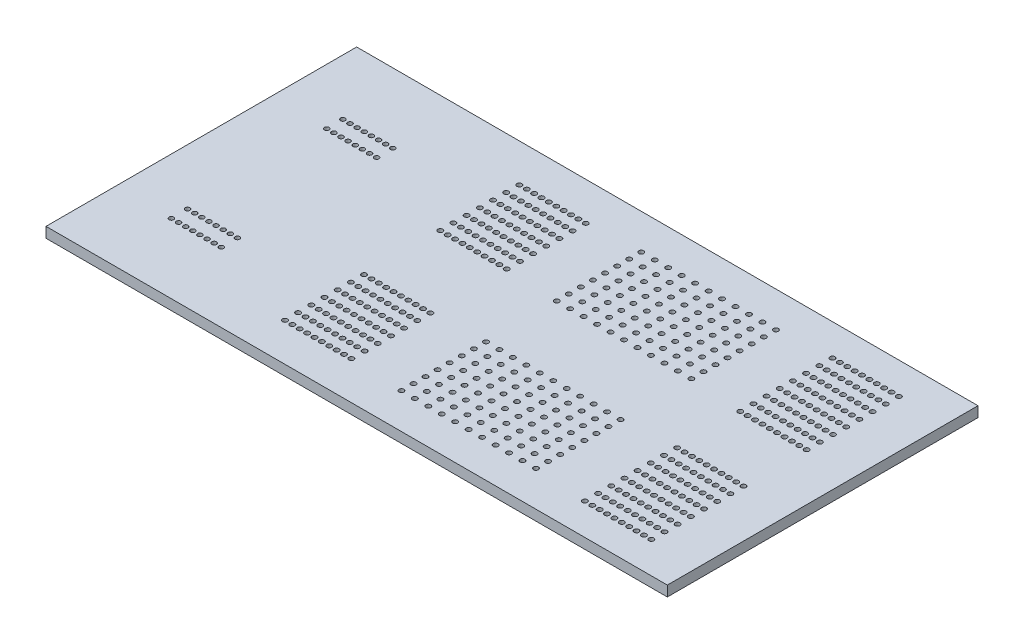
SolidWorks part; units mm, degrees
ref_plane "Plan de face" through (0, 0, 0) normal (0, 0, 1) x (1, 0, 0)
ref_plane "Plan de dessus" through (0, 0, 0) normal (0, 1, 0) x (1, 0, 0)
ref_plane "Plan de droite" through (0, 0, 0) normal (1, 0, 0) x (0, 0, -1)
sketch "Esquisse2" plane through (0, 0, 0) normal (0, 1, 0) x (1, 0, 0)
  line L1 (-60, -15) -> (60, -15)
  line L2 (-60, -15) -> (-60, 15)
  line L3 (-60, 15) -> (60, 15)
  line L4 (60, -15) -> (60, 15)
  line L5 (-60, -15) -> (60, 15) construction
  line L6 (-60, 15) -> (60, -15) construction
  point P0 (0, 0)
  dimension "D1" = 30
  dimension "D2" = 120
extrude "Boss.-Extru.1" add sketch "Esquisse2" along normal blind 2 contours L3 L4 L1 L2
sketch "Cavités" plane through (0, 0, 0) normal (0, 1, 0) x (1, 0, 0)
  line L0 (-60, -15) -> (60, -15) construction
  line L1 (-58.4, 15) -> (-30.4, 15) construction
  line L2 (-58.4, 15) -> (-58.4, -15) construction
  line L3 (-58.4, -15) -> (-30.4, -15) construction
  line L4 (-30.4, 15) -> (-30.4, -15) construction
  line L5 (-60, 15) -> (60, 15) construction
  line L6 (-28.8, 15) -> (-0.8, 15) construction
  line L7 (-28.8, 15) -> (-28.8, -15) construction
  line L8 (-28.8, -15) -> (-0.8, -15) construction
  line L9 (-0.8, 15) -> (-0.8, -15) construction
  line L10 (-30.4, 15) -> (-28.8, 15) construction
  line L11 (0.8, 15) -> (28.8, 15) construction
  line L12 (0.8, 15) -> (0.8, -15) construction
  line L13 (0.8, -15) -> (28.8, -15) construction
  line L14 (28.8, 15) -> (28.8, -15) construction
  line L15 (30.4, 15) -> (58.4, 15) construction
  line L16 (30.4, 15) -> (30.4, -15) construction
  line L17 (30.4, -15) -> (58.4, -15) construction
  line L18 (58.4, 15) -> (58.4, -15) construction
  line L19 (-0.8, 15) -> (0.8, 15) construction
  line L20 (28.8, 15) -> (30.4, 15) construction
  line L21 (-60, 15) -> (-58.4, 15) construction
  line L22 (58.4, 15) -> (60, 15) construction
  dimension "D1" = 28
  dimension "D2" = 1.6
sketch "Esquisse7" plane through (0, 2, 0) normal (0, 1, 0) x (1, 0, 0)
  line L0 (-58.4, 0) -> (-49.2195, 0) construction
  line L1 (-49.2195, 1.5555) -> (-39.5805, 1.5555) construction
  line L2 (-49.2195, 1.5555) -> (-49.2195, -1.5555) construction
  line L3 (-49.2195, -1.5555) -> (-39.5805, -1.5555) construction
  line L4 (-39.5805, 1.5555) -> (-39.5805, -1.5555) construction
  line L5 (-58.4, 15) -> (-58.4, -15) construction
  line L6 (-39.5805, 0) -> (-30.4, 0) construction
  line L7 (-30.4, 15) -> (-30.4, -15) construction
  dimension "D1" = 9.639
  dimension "D2" = 3.111
sketch "Esquisse8" plane through (0, 2, 0) normal (0, 1, 0) x (1, 0, 0)
  circle A0 centre (-49.2195, 1.5555) radius 0.45
  dimension "D1" = 0.9
extrude "Enlèv. mat.-Extru.3" cut sketch "Esquisse8" against normal up to next
pattern_linear "Répétition linéaire4" count 8 spacing 1.377 along (1, 0, 0) count 2 spacing 3.111 along (0, 0, 1) of "Enlèv. mat.-Extru.3"
sketch "Esquisse9" plane through (0, 2, 0) normal (0, 1, 0) x (1, 0, 0)
  line L0 (-28.8, 0) -> (-21.2125, 0) construction
  line L1 (-21.2125, 7.635) -> (-8.3875, 7.635) construction
  line L2 (-21.2125, 7.635) -> (-21.2125, -7.635) construction
  line L3 (-21.2125, -7.635) -> (-8.3875, -7.635) construction
  line L4 (-8.3875, 7.635) -> (-8.3875, -7.635) construction
  line L5 (-28.8, 15) -> (-28.8, -15) construction
  line L6 (-8.3875, 0) -> (-0.8, 0) construction
  line L7 (-0.8, 15) -> (-0.8, -15) construction
  dimension "D1" = 12.825
  dimension "D2" = 15.27
sketch "Esquisse10" plane through (0, 2, 0) normal (0, 1, 0) x (1, 0, 0)
  circle A0 centre (-21.2125, 7.635) radius 0.475
  dimension "D1" = 0.95
extrude "Enlèv. mat.-Extru.4" cut sketch "Esquisse10" against normal up to next
pattern_linear "Répétition linéaire5" count 10 spacing 1.425 along (1, 0, 0) count 7 spacing 2.545 along (0, 0, 1) of "Enlèv. mat.-Extru.4"
sketch "Esquisse11" plane through (0, 2, 0) normal (0, 1, 0) x (1, 0, 0)
  line L0 (0.8, 0) -> (1.8, 0) construction
  line L1 (1.8, 8.1655) -> (27.8, 8.1655) construction
  line L2 (1.8, 8.1655) -> (1.8, -8.1655) construction
  line L3 (1.8, -8.1655) -> (27.8, -8.1655) construction
  line L4 (27.8, 8.1655) -> (27.8, -8.1655) construction
  line L5 (0.8, 15) -> (0.8, -15) construction
  line L6 (27.8, 0) -> (28.8, 0) construction
  line L7 (28.8, 15) -> (28.8, -15) construction
  dimension "D1" = 26
  dimension "D2" = 16.331
sketch "Esquisse12" plane through (0, 2, 0) normal (0, 1, 0) x (1, 0, 0)
  circle A0 centre (1.8, 8.1655) radius 0.475
  dimension "D1" = 0.95
extrude "Enlèv. mat.-Extru.5" cut sketch "Esquisse12" against normal up to next
pattern_linear "Répétition linéaire6" count 11 spacing 2.6 along (1, 0, 0) count 8 spacing 2.333 along (0, 0, 1) of "Enlèv. mat.-Extru.5"
sketch "Esquisse13" plane through (0, 2, 0) normal (0, 1, 0) x (1, 0, 0)
  line L0 (30.4, 0) -> (37.9875, 0) construction
  line L1 (37.9875, 8.9075) -> (50.8125, 8.9075) construction
  line L2 (37.9875, 8.9075) -> (37.9875, -8.9075) construction
  line L3 (37.9875, -8.9075) -> (50.8125, -8.9075) construction
  line L4 (50.8125, 8.9075) -> (50.8125, -8.9075) construction
  line L5 (30.4, 15) -> (30.4, -15) construction
  line L6 (50.8125, 0) -> (58.4, 0) construction
  line L7 (58.4, 15) -> (58.4, -15) construction
  dimension "D1" = 17.815
  dimension "D2" = 12.825
sketch "Esquisse14" plane through (0, 2, 0) normal (0, 1, 0) x (1, 0, 0)
  circle A0 centre (37.9875, 8.9075) radius 0.475
  dimension "D1" = 0.95
extrude "Enlèv. mat.-Extru.6" cut sketch "Esquisse14" against normal up to next
pattern_linear "Répétition linéaire7" count 10 spacing 1.425 along (1, 0, 0) count 8 spacing 2.545 along (0, 0, 1) of "Enlèv. mat.-Extru.6"
mirror "Symétrie1" about plane through (-60, 2, 15) normal (0, 0, -1)
